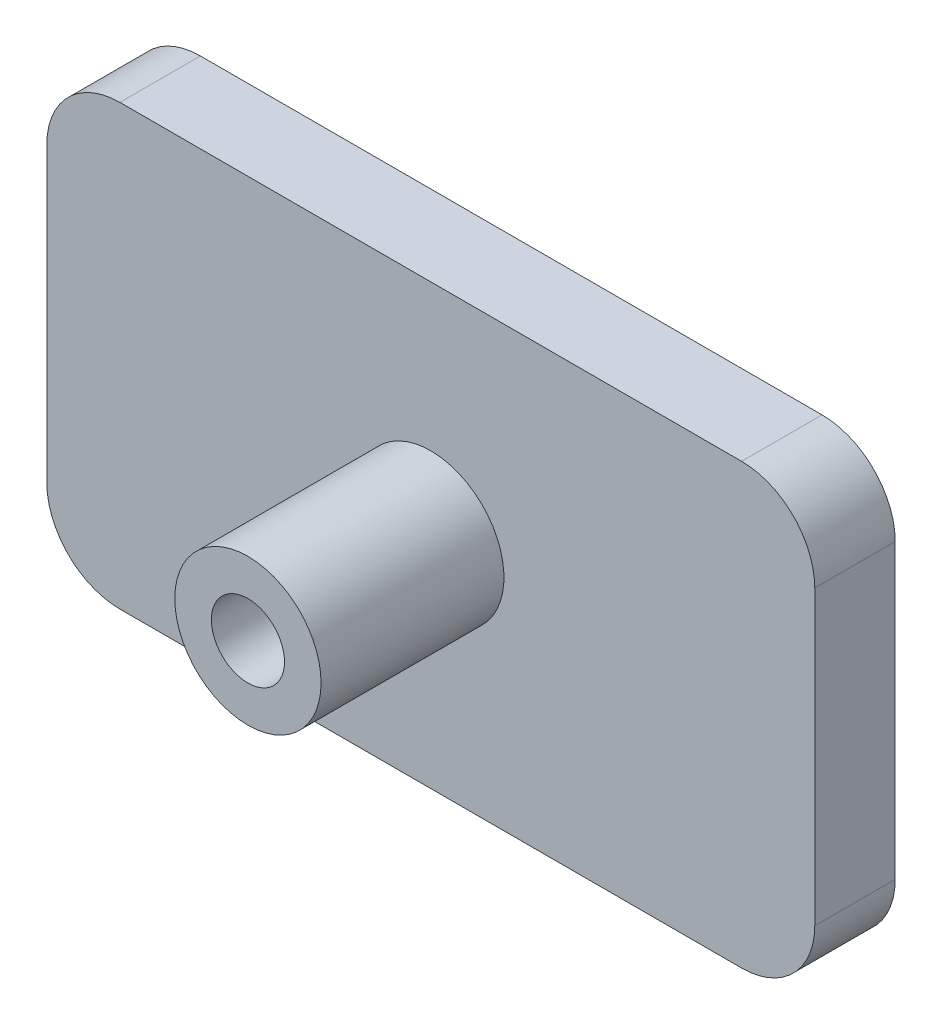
SolidWorks part; units mm, degrees
ref_plane "Plan de face" through (0, 0, 0) normal (0, 0, 1) x (1, 0, 0)
ref_plane "Plan de dessus" through (0, 0, 0) normal (0, 1, 0) x (1, 0, 0)
ref_plane "Plan de droite" through (0, 0, 0) normal (1, 0, 0) x (0, 0, -1)
sketch "Esquisse4" plane through (0, 0, 0) normal (0, 0, 1) x (1, 0, 0)
  line L1 (-8.5, -6) -> (8.5, -6)
  line L2 (-10.5, -4) -> (-10.5, 4)
  line L3 (-8.5, 6) -> (8.5, 6)
  line L4 (10.5, -4) -> (10.5, 4)
  line L5 (-10.5, -6) -> (10.5, 6) construction
  line L6 (-10.5, 6) -> (10.5, -6) construction
  arc A0 (-8.5, -6) -> (-10.5, -4) centre (-8.5, -4) cw
  arc A1 (8.5, -6) -> (10.5, -4) centre (8.5, -4) ccw
  arc A2 (8.5, 6) -> (10.5, 4) centre (8.5, 4) cw
  arc A3 (-10.5, 4) -> (-8.5, 6) centre (-8.5, 4) cw
  circle A4 centre (0, 0) radius 1
  point P0 (0, 0)
  dimension "D3" = 2
  dimension "D1" = 12
  dimension "D2" = 21
extrude "Boss.-Extru.3" add sketch "Esquisse4" along normal blind 2.2
sketch "Esquisse5" plane through (0, 0, 0) normal (0, 0, -1) x (-1, 0, 0)
  line L1 (-8.5, -5) -> (8.5, -5)
  line L2 (-9.5, -4) -> (-9.5, 4)
  line L3 (-8.5, 5) -> (8.5, 5)
  line L4 (9.5, -4) -> (9.5, 4)
  line L5 (-9.5, -5) -> (9.5, 5) construction
  line L6 (-9.5, 5) -> (9.5, -5) construction
  arc A0 (8.5, 5) -> (9.5, 4) centre (8.5, 4) cw
  arc A1 (8.5, -5) -> (9.5, -4) centre (8.5, -4) ccw
  arc A2 (-8.5, -5) -> (-9.5, -4) centre (-8.5, -4) cw
  arc A3 (-9.5, 4) -> (-8.5, 5) centre (-8.5, 4) cw
  point P0 (0, 0)
  dimension "D3" = 1
  dimension "D1" = 10
  dimension "D2" = 19
extrude "Enlèv. mat.-Extru.2" cut sketch "Esquisse5" against normal blind 1.1
sketch "Esquisse6" plane through (0, 0, 2.2) normal (0, 0, 1) x (1, 0, 0)
  circle A0 centre (0, 0) radius 1
  circle A1 centre (0, 0) radius 2
extrude "Boss.-Extru.4" add sketch "Esquisse6" along normal blind 5
